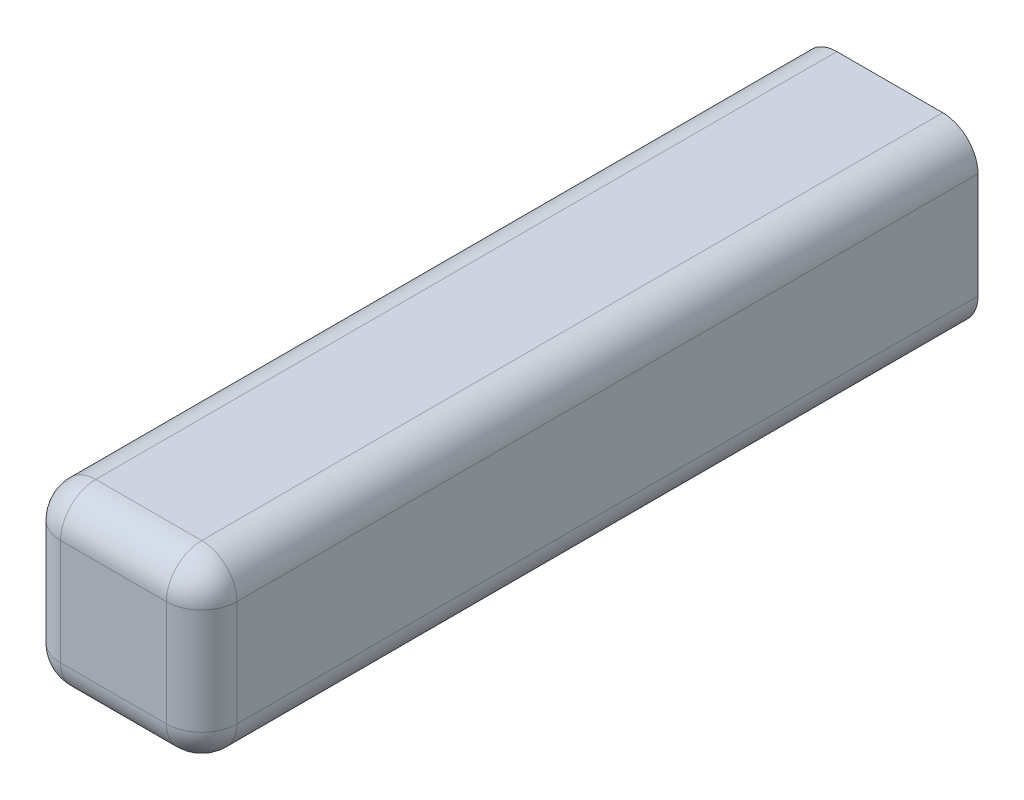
SolidWorks part; units mm, degrees
ref_plane "Ebene vorne" through (0, 0, 0) normal (0, 0, 1) x (1, 0, 0)
ref_plane "Ebene oben" through (0, 0, 0) normal (0, 1, 0) x (1, 0, 0)
ref_plane "Ebene rechts" through (0, 0, 0) normal (1, 0, 0) x (0, 0, -1)
sketch "Skizze2" plane through (0, 0, 0) normal (0, 0, 1) x (1, 0, 0)
  line L1 (0, 0) -> (5, 0)
  line L2 (0, 0) -> (0, 5)
  line L3 (0, 5) -> (5, 5)
  line L4 (5, 0) -> (5, 5)
  dimension "D1" = 5
  dimension "D2" = 5
extrude "Aufsatz-Linear austragen2" add sketch "Skizze2" along normal blind 22
sketch "Skizze4" plane through (0, 0, 0) normal (0, 0, -1) x (-1, 0, 0)
  line L0 (-5, 5) -> (0, 5) construction
  line L1 (-3.5, 3.5) -> (-1.5, 3.5)
  line L2 (-3.5, 3.5) -> (-3.5, 1.5)
  line L3 (-3.5, 1.5) -> (-1.5, 1.5)
  line L4 (-1.5, 3.5) -> (-1.5, 1.5)
  line L5 (-5, 0) -> (-5, 5) construction
  dimension "D1" = 1.5
  dimension "D2" = 1.5
  dimension "D3" = 2
  dimension "D4" = 2
extrude "Schnitt-Linear austragen1" cut sketch "Skizze4" against normal blind 19
fillet "Verrundung1" radius 1 12 edges at (2.5, 1.5, 0) (1.5, 2.5, 0) (2.5, 3.5, 0) (3.5, 2.5, 0) (2.5, 0, 22) (5, 0, 11) (5, 2.5, 22) (5, 5, 11) (2.5, 5, 22) (0, 5, 11) (0, 2.5, 22) (0, 0, 11)
